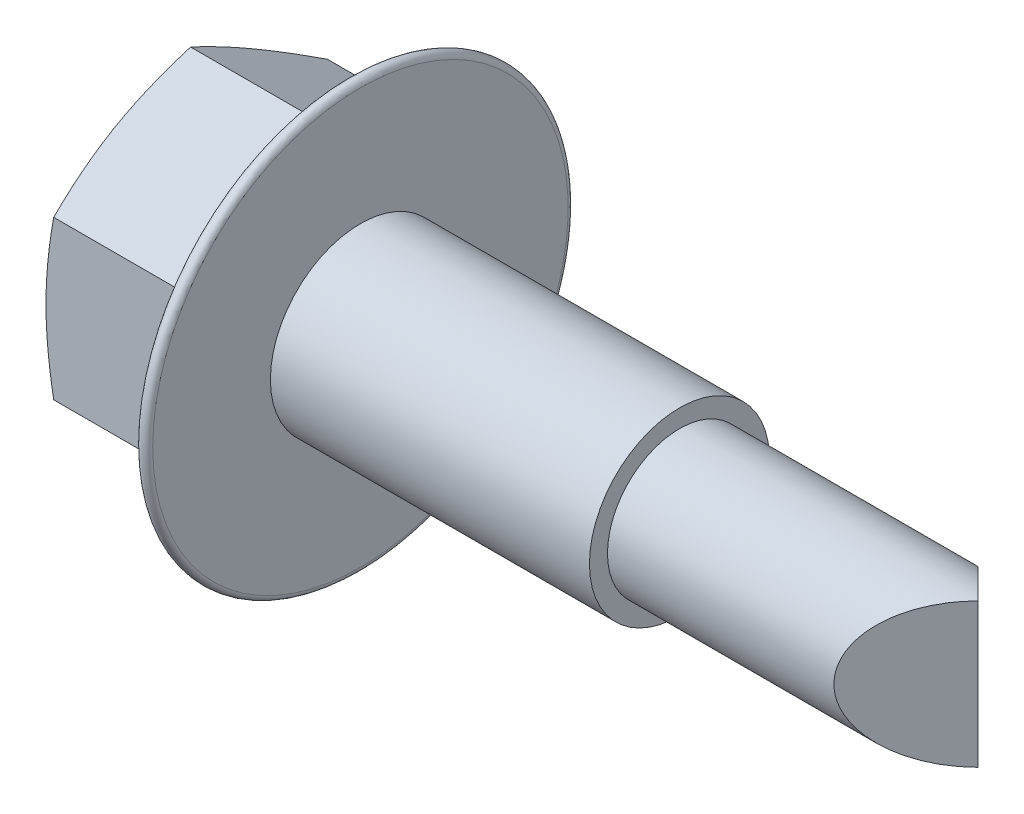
SolidWorks part; units mm, degrees
ref_plane "Front" through (0, 0, 0) normal (0, 0, 1) x (1, 0, 0)
ref_plane "Top" through (0, 0, 0) normal (0, 1, 0) x (1, 0, 0)
ref_plane "Right" through (0, 0, 0) normal (1, 0, 0) x (0, 0, -1)
other "Configuration Table"
sketch "Sketch1" plane through (0, 0, 0) normal (0, 0, 1) x (1, 0, 0)
  line L0 (-5.817, 0) -> (26.9196, 0) construction
  line L1 (0, 0) -> (0, 1.75)
  line L2 (0, 1.75) -> (6.2, 1.75)
  line L3 (6.2, 1.75) -> (6.2, 1.4)
  line L4 (6.2, 1.4) -> (12, 1.4)
  line L5 (12, 1.4) -> (12, 0)
  line L6 (12, 0) -> (0, 0)
  line L7 (1.3, 4.1877) -> (1.3, -5.1194) construction
revolve "BaseBody" add sketch "Sketch1" angle 360 about L0
sketch "Sketch2" plane through (0, 0, 0) normal (0, 1, 0) x (1, 0, 0)
  line L0 (11.6965, 0) -> (13.6929, 0) construction
  line L2 (12.4565, -10) -> (12.4565, 10)
  line L3 (12.4565, 10) -> (2, 10)
  line L4 (2, 10) -> (12, 0)
  line L6 (2, -10) -> (12, 0)
  line L7 (12.4565, -10) -> (2, -10)
  line L8 (12, -1.4) -> (12, 1.4) construction
  point P12 (12.4565, 0)
  dimension "D1" = 45
  dimension "D2" = 10
  dimension "D3" = 0.4565
extrude "Cut-Extrude1" cut sketch "Sketch2" against normal through all and the other way through all
sketch "Sketch3" plane through (0, 0, 0) normal (1, 0, 0) x (0, 0, -1)
  line L1 (0, -3.0715) -> (2.66, -1.5358)
  line L2 (2.66, -1.5358) -> (2.66, 1.5358)
  line L3 (2.66, 1.5358) -> (0, 3.0715)
  line L4 (0, 3.0715) -> (-2.66, 1.5358)
  line L5 (-2.66, 1.5358) -> (-2.66, -1.5358)
  line L6 (-2.66, -1.5358) -> (0, -3.0715)
  circle A0 centre (0, 0) radius 2.66 construction
extrude "BaseHead" add sketch "Sketch3" against normal blind 3.45
sketch "Sketch4" plane through (0, 0, 0) normal (0, 1, 0) x (1, 0, 0)
  line L0 (-3.45, 15) -> (-3.45, 2.66)
  line L1 (-3.45, 2.66) -> (1.0414, 15)
  line L2 (1.0414, 15) -> (-3.45, 15)
  line L3 (0, 0) -> (-8.4371, 0) construction
  line L6 (-3.45, 0) -> (-3.45, 2.66) construction
revolve "Cut-Revolve1" cut sketch "Sketch4" angle 360 about L3
sketch "Sketch5" plane through (0, 0, 0) normal (0, 1, 0) x (1, 0, 0)
  line L0 (-28.7244, 0) -> (3.8463, 0) construction
  line L2 (0, 0) -> (0, 4.0364)
  line L3 (-0.2233, 4.0658) -> (-1.3127, 0)
  line L6 (0, 0) -> (-1.3127, 0)
  arc A0 (0, 4.0364) -> (-0.2233, 4.0658) centre (-0.1136, 4.0364) ccw
  point P6 (-0.6, 2.66)
revolve "Revolve2" add sketch "Sketch5" angle 360 about L0
fillet "Fillet1" [suppressed] radius 0.5
fillet "Fillet2" radius 0.2 6 edges
sketch "Sketch6" plane through (0, 0, 0) normal (0, 0, 1) x (1, 0, 0)
  line L0 (0, 0) -> (8.1294, 0) construction
  line L1 (1.0979, 2.1541) -> (1.5021, 2.1541)
  line L2 (1.5021, 1.75) -> (1.3, 1.4)
  line L3 (1.3, 1.4) -> (1.0979, 1.75)
  line L4 (1.0979, 1.75) -> (1.0979, 2.1541)
  line L5 (1.5021, 2.1541) -> (1.5021, 1.75)
  line L6 (0, -4.0364) -> (0, 4.0364) construction
revolve "Cut-Revolve10" [suppressed] cut sketch "Sketch6" angle 360 about L0
pattern_linear "LPattern10" [suppressed] count 10 spacing 0.525 along (1, 0, 0)
sketch "Sketch7" plane through (0, 0, 0) normal (0, 1, 0) x (1, 0, 0)
  line L0 (-3.45, 0) -> (-6.4074, 0) construction
  line L1 (-3.45, 0) -> (-3.0188, 0)
  line L2 (-3.45, 0) -> (-3.45, 2.2167)
  line L3 (-3.45, 2.2167) -> (-3.0188, 2.2167)
  line L4 (-3.0188, 0) -> (-3.0188, 2.2167)
  line L5 (-3.45, 1.33) -> (-3.45, -1.33) construction
revolve "Cut-Revolve11" cut sketch "Sketch7" angle 360 about L0
equation "\"D1@ThreadCosmetic1\" = \"lg@Sketch1\""
equation "\"D2@ThreadCosmetic1\" = \"dp@Sketch1\""
equation "\"D1@Sketch3\" =\"s@Sketch4\""
equation "\"D2@Sketch5\" = \"D1@Sketch3\" / 2"
equation "\"D1@Sketch6\" = \"dp@Sketch1\""
equation "\"D2@Sketch6\" = \"d@Sketch1\""
equation "\"D3@Sketch6\" = \"a@Sketch1\""
equation "\"D3@LPattern10\" = (\"d@Sketch1\"-\"dp@Sketch1\") / 2*1.5"
equation "\"D1@LPattern10\" = (  \"lg@Sketch1\" - \"a@Sketch1\" )  / \"D3@LPattern10\" + 1"
equation "\"D1@Sketch7\" = \"D1@Sketch3\" * 5 / 6"
equation "\"D2@Sketch7\" = \"k@BaseHead\" / 8"
